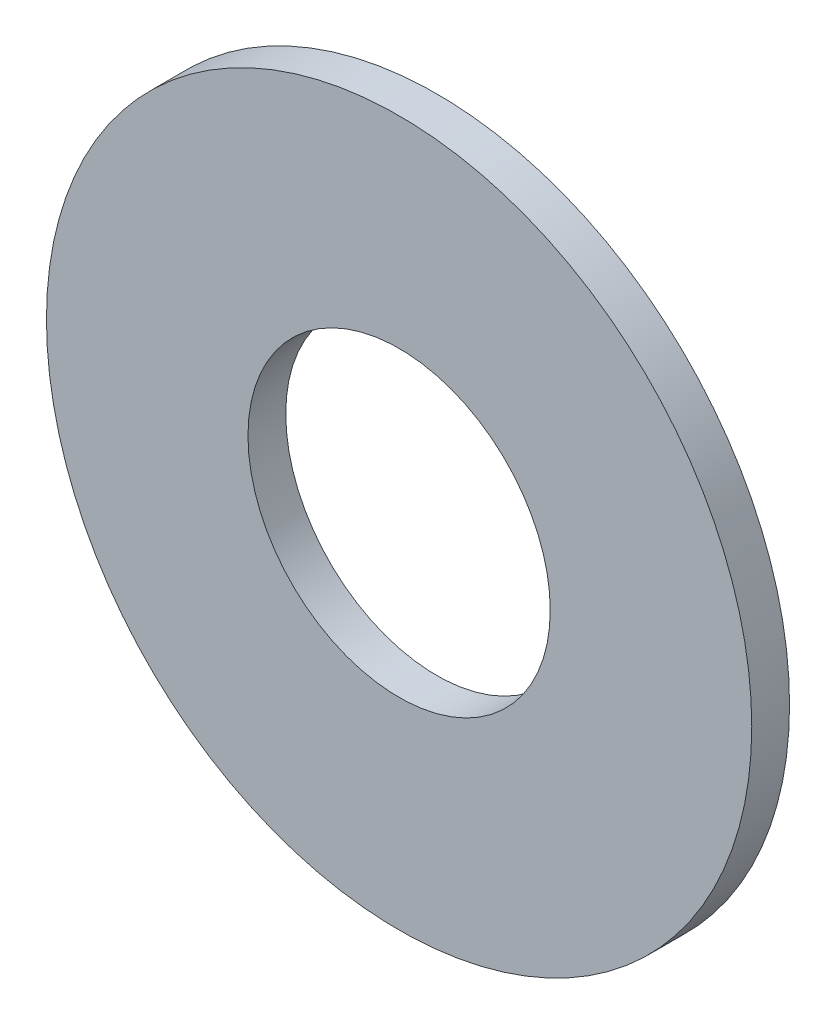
SolidWorks part; units mm, degrees
ref_plane "Face" through (0, 0, 0) normal (0, 0, 1) x (1, 0, 0)
ref_plane "Dessus" through (0, 0, 0) normal (0, 1, 0) x (1, 0, 0)
ref_plane "Droite" through (0, 0, 0) normal (1, 0, 0) x (0, 0, -1)
sketch "Esquisse1" plane through (0, 0, 0) normal (0, 0, 1) x (1, 0, 0)
  circle A0 centre (0, 0) radius 12
  circle A1 centre (0, 0) radius 28
  dimension "D1" = 24
  dimension "D2" = 56
extrude "Extrusion1" add sketch "Esquisse1" along normal blind 3
